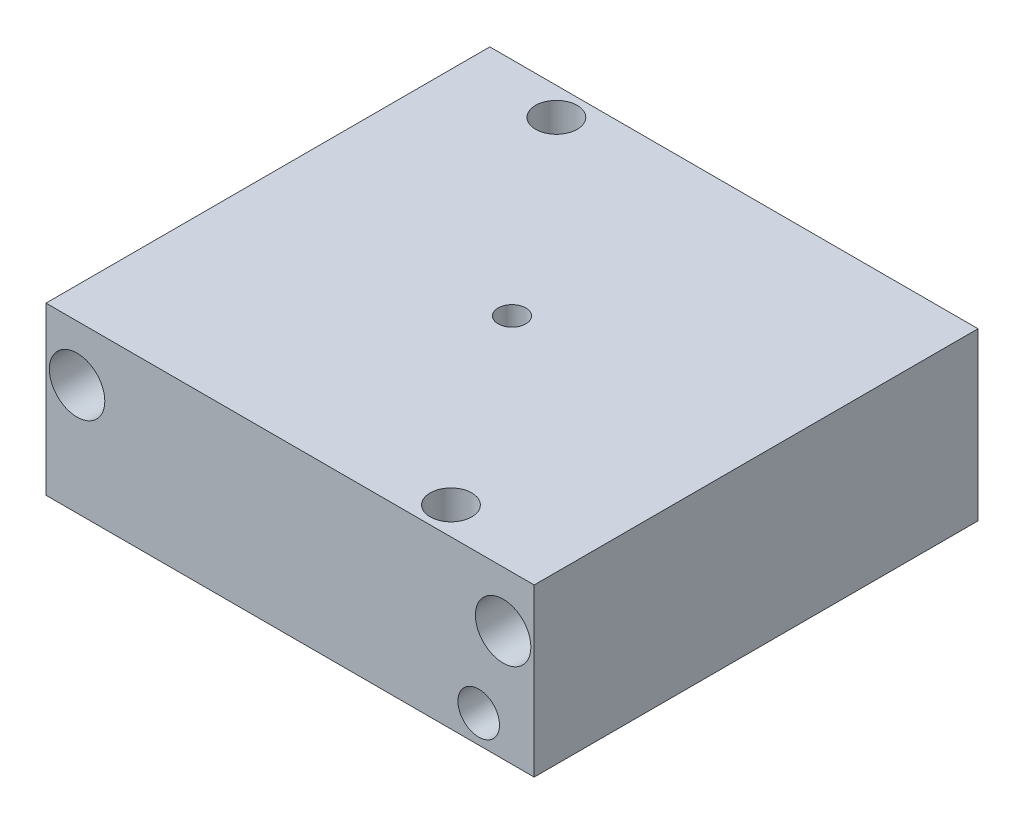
SolidWorks part; units mm, degrees
ref_plane "Front Plane" through (0, 0, 0) normal (0, 0, 1) x (1, 0, 0)
ref_plane "Top Plane" through (0, 0, 0) normal (0, 1, 0) x (1, 0, 0)
ref_plane "Right Plane" through (0, 0, 0) normal (1, 0, 0) x (0, 0, -1)
sketch "Sketch1" plane through (0, 0, 0) normal (0, 1, 0) x (1, 0, 0)
  line L1 (-58.943, 69.2319) -> (52.817, 69.2319)
  line L2 (-58.943, 69.2319) -> (-58.943, -32.3681)
  line L3 (-58.943, -32.3681) -> (52.817, -32.3681)
  line L4 (52.817, 69.2319) -> (52.817, -32.3681)
  dimension "D1" = 111.76
  dimension "D2" = 101.6
extrude "Extrude1" add sketch "Sketch1" along normal blind 38.1
sketch "Sketch3" plane through (0, 0, 32.3681) normal (0, 0, 1) x (1, 0, 0)
  line L0 (52.817, 38.1) -> (52.817, 0) construction
  line L1 (-58.943, 0) -> (52.817, 0) construction
  circle A0 centre (40.117, 6.35) radius 4.7625
  dimension "D1" = 12.7
  dimension "D2" = 6.35
extrude "Cut-Extrude2" cut sketch "Sketch3" against normal through all
sketch "Sketch5" plane through (0, 0, 32.3681) normal (0, 0, 1) x (1, 0, 0)
  line L0 (-58.943, 38.1) -> (52.817, 38.1) construction
  circle A0 centre (45.705, 25.4) radius 6.35
  circle A1 centre (-51.831, 25.4) radius 6.35
  point P4 (-3.063, 38.1)
  dimension "D1" = 97.536
  dimension "D2" = 48.768
extrude "Cut-Extrude3" cut sketch "Sketch5" against normal blind 190.5
sketch "Sketch6" plane through (0, 38.1, 0) normal (0, 1, 0) x (-1, 0, 0)
  line L0 (-52.817, 32.3681) -> (-52.817, -69.2319) construction
  line L1 (58.943, 32.3681) -> (-52.817, 32.3681) construction
  line L2 (58.943, -69.2319) -> (58.943, 32.3681) construction
  line L5 (-52.817, -69.2319) -> (58.943, -69.2319) construction
  circle A0 centre (-27.417, 26.0181) radius 4.7625
  circle A1 centre (37.353, -62.8819) radius 4.7625
  dimension "D5" = 9.525
  dimension "D6" = 9.525
  dimension "D1" = 25.4
  dimension "D2" = 6.35
  dimension "D3" = 21.59
  dimension "D4" = 6.35
sketch "Sketch7" plane through (0, 38.1, 0) normal (0, 1, 0) x (-1, 0, 0)
  line L0 (58.943, 32.3681) -> (-52.817, 32.3681) construction
  line L1 (58.943, -69.2319) -> (58.943, 32.3681) construction
  circle A0 centre (3.063, -18.4319) radius 3.175
  dimension "D1" = 50.8
  dimension "D2" = 55.88
extrude "Cut-Extrude4" cut sketch "Sketch6" against normal through all contours A0 | A1
extrude "Cut-Extrude5" cut sketch "Sketch7" against normal through all
